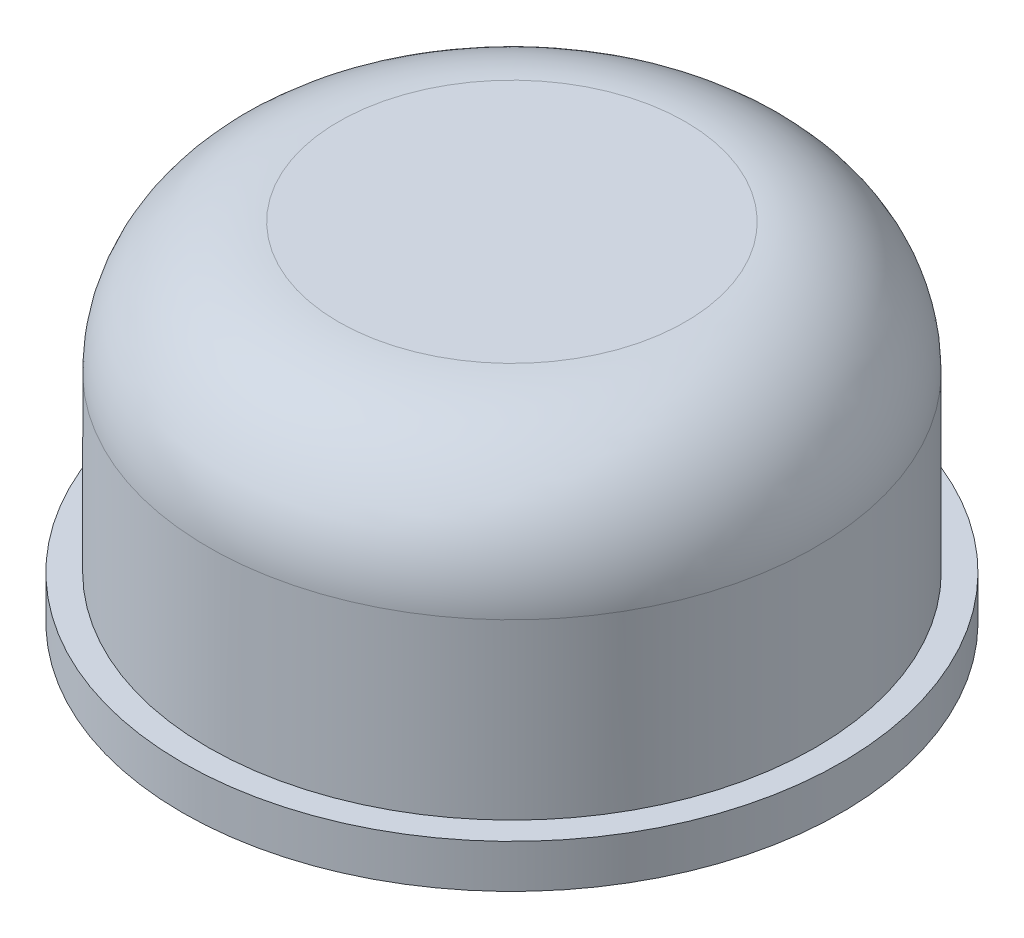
SolidWorks part; units mm, degrees
ref_plane "Plane1" through (0, 0, 0) normal (0, 0, 1) x (1, 0, 0)
ref_plane "Plane2" through (0, 0, 0) normal (0, 1, 0) x (1, 0, 0)
ref_plane "Plane3" through (0, 0, 0) normal (1, 0, 0) x (0, 0, -1)
sketch "Sketch1" plane through (0, 0, 0) normal (0, 0, 1) x (1, 0, 0)
  line L0 (0, 0) -> (0, 11.6972) construction
  line L1 (0, 0) -> (8.89, 0)
  line L2 (8.89, 0) -> (8.89, 6.35)
  line L3 (5.08, 10.16) -> (0, 10.16)
  line L4 (0, 10.16) -> (0, 0)
  arc A0 (8.89, 6.35) -> (5.08, 10.16) centre (5.08, 6.35) ccw
  point P8 (8.89, 0)
  point P9 (-8.89, 0)
  dimension "D2" = 3.81
  dimension "D1" = 17.78
  dimension "D3" = 10.16
revolve "Body" add sketch "Sketch1" angle 180 about L0
sketch "Sketch2" plane through (0, 0, 0) normal (0, 0, 1) x (1, 0, 0)
  line L0 (0, 0) -> (0, 10.16) construction
  line L1 (-5.08, 10.16) -> (5.08, 10.16) construction
  line L2 (0, 0) -> (8.128, 0)
  line L3 (8.89, 0) -> (-8.89, 0) construction
  line L4 (8.128, 0) -> (8.128, 5.842)
  line L5 (5.08, 8.89) -> (0, 8.89)
  line L6 (0, 8.89) -> (0, 0)
  line L7 (8.89, 0) -> (8.89, 6.35) construction
  arc A0 (8.128, 5.842) -> (5.08, 8.89) centre (5.08, 5.842) ccw
  dimension "D3" = 3.048
  dimension "D1" = 0.762
  dimension "D2" = 1.27
revolve "Inside" cut sketch "Sketch2" angle 180 about L0
mirror "Mirror"
sketch "Sketch4" plane through (0, 0, 0) normal (0, 1, 0) x (1, 0, 0)
  circle A0 centre (0, 0) radius 8.89 construction
  circle A1 centre (0, 0) radius 9.652
  circle A2 centre (0, 0) radius 9.652
  circle A3 centre (0, 0) radius 8.89
  dimension "D1" = 0.762
extrude "Lip" add sketch "Sketch4" along normal blind 1.27
